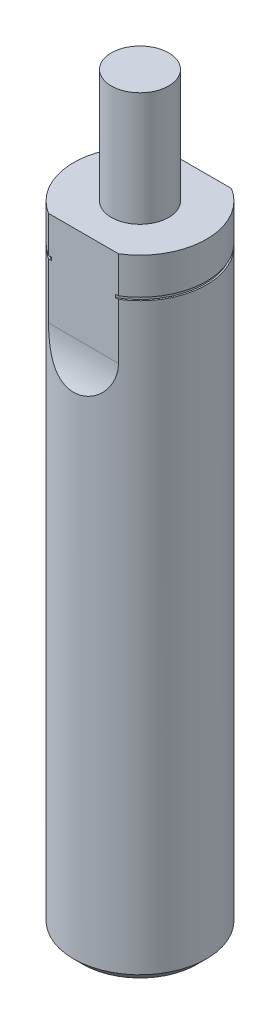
SolidWorks part; units mm, degrees
ref_plane "Front Plane" through (0, 0, 0) normal (0, 0, 1) x (1, 0, 0)
ref_plane "Top Plane" through (0, 0, 0) normal (0, 1, 0) x (1, 0, 0)
ref_plane "Right Plane" through (0, 0, 0) normal (1, 0, 0) x (0, 0, -1)
sketch "Sketch1" plane through (0, 0, 0) normal (0, 1, 0) x (1, 0, 0)
  circle A0 centre (0, 0) radius 5.5562
  dimension "D1" = 11.1125
extrude "Boss-Extrude1" add sketch "Sketch1" along normal blind 52.9082
sketch "Sketch2" plane through (0, 52.9082, 0) normal (0, 1, 0) x (1, 0, 0)
  circle A0 centre (0, 0) radius 2.3978
  dimension "D1" = 4.7955
extrude "Boss-Extrude2" add sketch "Sketch2" along normal blind 9.525
sketch "Sketch3" plane through (0, 0, 0) normal (1, 0, 0) x (0, 0, -1)
  line L0 (4.7244, 52.9082) -> (4.7244, 44.9707)
  line L1 (5.5562, 52.9082) -> (-5.5562, 52.9082) construction
  line L2 (0, 0) -> (0, 74.2683) construction
  line L3 (4.7244, 52.9082) -> (7.0866, 52.9082)
  line L4 (7.0866, 40.029) -> (7.0866, 52.9082)
  line L5 (-7.0866, 40.029) -> (-7.0866, 52.9082)
  line L6 (-4.7244, 52.9082) -> (-7.0866, 52.9082)
  line L7 (-4.7244, 52.9082) -> (-4.7244, 44.9707)
  arc A0 (4.7244, 44.9707) -> (7.0866, 40.029) centre (11.0744, 44.9707) ccw
  arc A1 (-4.7244, 44.9707) -> (-7.0866, 40.029) centre (-11.0744, 44.9707) cw
  dimension "D2" = 6.35
  dimension "D1" = 7.9375
  dimension "D3" = 9.4488
  dimension "D4" = 2.3622
extrude "Cut-Extrude1" cut sketch "Sketch3" against normal through all and the other way through all
sketch "Sketch4" plane through (0, 0, 0) normal (0, 0, 1) x (1, 0, 0)
  line L0 (5.5562, 0) -> (5.5562, 52.9082) construction
  line L1 (5.5562, 49.8602) -> (5.4292, 49.8602)
  line L2 (5.5562, 49.8602) -> (5.5562, 49.6062)
  line L3 (5.5562, 49.6062) -> (5.4292, 49.6062)
  line L4 (5.4292, 49.8602) -> (5.4292, 49.6062)
  line L5 (-2.9244, 52.9082) -> (2.9244, 52.9082) construction
  line L6 (0, 0) -> (0, 94.4487) construction
  point P6 (5.5562, 49.7332)
  dimension "D1" = 0.254
  dimension "D2" = 3.175
  dimension "D3" = 0.127
revolve "Cut-Revolve1" cut sketch "Sketch4" angle 360 about L6
chamfer "Chamfer1" distance 0.7937 angle 45 1 edges at (0, 0, 5.5562)
